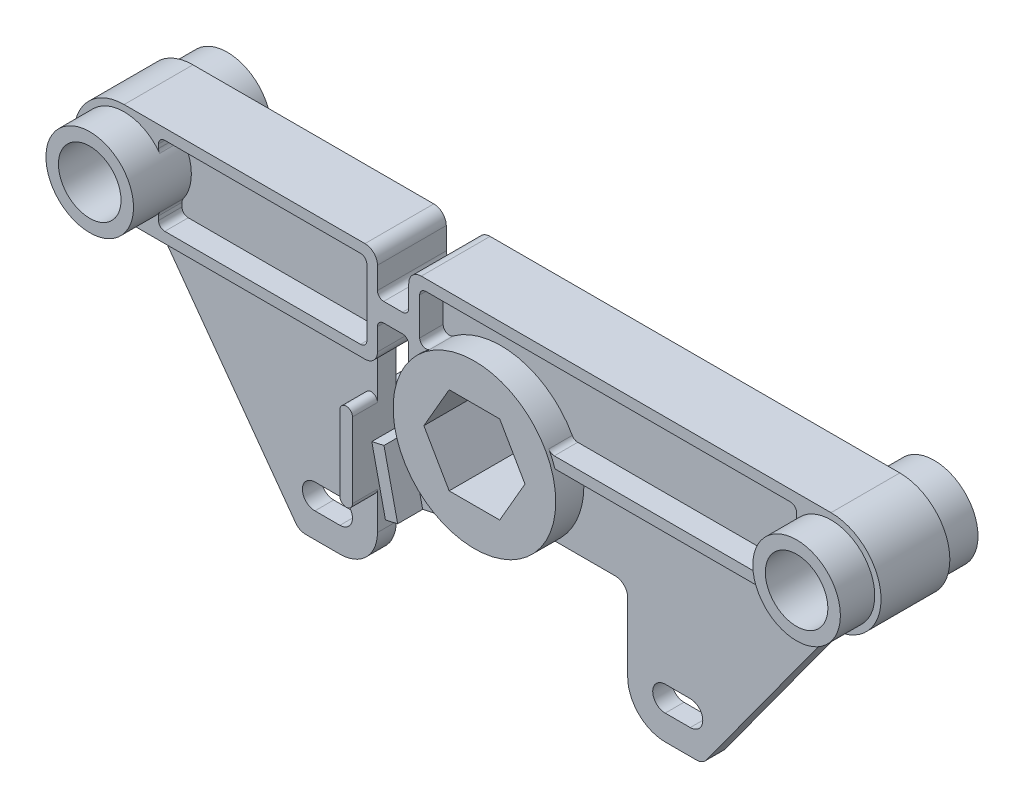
SolidWorks part; units mm, degrees
ref_plane "Plan1" through (0, 0, 0) normal (0, 0, 1) x (1, 0, 0)
ref_plane "Plan2" through (0, 0, 0) normal (0, 1, 0) x (1, 0, 0)
ref_plane "Plan3" through (0, 0, 0) normal (1, 0, 0) x (0, 0, -1)
sketch "Esquisse1" plane through (0, 0, 0) normal (0, 0, 1) x (1, 0, 0)
  circle A0 centre (0, 0) radius 13
  dimension "D1" = 26
extrude "Moyeu" add sketch "Esquisse1" along normal mid plane 12
sketch "Esquisse2" plane through (0, 0, 0) normal (0, 0, 1) x (1, 0, 0)
  line L0 (-11, 20) -> (56.5, 20)
  line L1 (-11, 20) -> (-11, 13.5)
  line L2 (-11, 4) -> (56.5, 4)
  line L3 (-16, 20) -> (-16, 13.5)
  line L4 (-16, 20) -> (-56.5, 20)
  line L5 (-16, 4) -> (-56.5, 4)
  line L6 (-16, 13.5) -> (-11, 13.5)
  line L7 (-16, 10.5) -> (-11, 10.5)
  line L8 (-16, 10.5) -> (-16, 4)
  line L9 (-11, 10.5) -> (-11, 4)
  arc A0 (56.5, 4) -> (56.5, 20) centre (56.5, 12) ccw
  arc A1 (-56.5, 20) -> (-56.5, 4) centre (-56.5, 12) ccw
  dimension "D1" = 20
  dimension "D2" = 11
  dimension "D3" = 16
  dimension "D4" = 67.5
  dimension "D5" = 5
  dimension "D6" = 40.5
  dimension "D7" = 3
  dimension "D8" = 1.5
extrude "poutre" add sketch "Esquisse2" along normal mid plane 11
sketch "Esquisse3" plane through (0, 0, 0) normal (0, 0, 1) x (1, 0, 0)
  circle A0 centre (56.5, 12) radius 7
  dimension "D1" = 14
extrude "palier grand côté" add sketch "Esquisse3" along normal mid plane 22
sketch "Esquisse7" plane through (0, 0, 0) normal (0, 0, 1) x (1, 0, 0)
  circle A0 centre (-56.5, 12) radius 7
  arc A1 (-56.5, 20) -> (-56.5, 4) centre (-56.5, 12) ccw construction
  dimension "D1" = 14
extrude "palier petit côté" add sketch "Esquisse7" along normal mid plane 22
sketch "Esquisse8" plane through (0, 0, 11) normal (0, 0, 1) x (1, 0, 0)
  circle A0 centre (-56.5, 12) radius 5
  circle A1 centre (-56.5, 12) radius 7 construction
  dimension "D1" = 10
extrude "alésage petit côté" cut sketch "Esquisse8" against normal through all
sketch "Esquisse9" plane through (0, 0, 11) normal (0, 0, 1) x (1, 0, 0)
  circle A0 centre (56.5, 12) radius 5
  circle A1 centre (56.5, 12) radius 7 construction
  dimension "D1" = 10
extrude "alésage grand côté" cut sketch "Esquisse9" against normal through all
sketch "Esquisse10" plane through (0, 0, 5.5) normal (0, 0, 1) x (1, 0, 0)
  line L10 (-51, 18.3) -> (-51, 16.3301)
  line L11 (-51, 7.6699) -> (-51, 5.7)
  line L12 (-17.7, 5.7) -> (-17.7, 18.3)
  line L13 (-17.7, 5.7) -> (-17.7, 18.3)
  line L20 (-17.7, 18.3) -> (-56.5, 18.3)
  line L21 (-56.5, 5.7) -> (-17.7, 5.7)
  line L23 (-17.7, 18.3) -> (-51, 18.3)
  line L24 (-51, 5.7) -> (-17.7, 5.7)
  circle A3 centre (-56.5, 12) radius 7 construction
  arc A4 (-51, 7.6699) -> (-51, 16.3301) centre (-56.5, 12) ccw
  arc A6 (-56.5, 18.3) -> (-56.5, 5.7) centre (-56.5, 12) ccw
  dimension "D2" = 5.5
  dimension "D1" = 1.7
extrude "évidement poutre petit côté" cut sketch "Esquisse10" against normal blind 3.75
sketch "Esquisse11" plane through (0, 0, 5.5) normal (0, 0, 1) x (1, 0, 0)
  line L0 (51, 18.25) -> (-9.25, 18.25)
  line L1 (56.5, 20) -> (-11, 20) construction
  line L2 (51, 5.75) -> (11.6592, 5.75)
  line L4 (12.3693, 4) -> (56.5, 4) construction
  line L5 (-9.25, 18.25) -> (-9.25, 9.1344)
  line L6 (-11, 20) -> (-11, 13.5) construction
  line L7 (51, 18.25) -> (51, 16.3301)
  line L8 (51, 7.6699) -> (51, 5.75)
  circle A0 centre (0, 0) radius 13 construction
  arc A1 (11.6592, 5.75) -> (-9.25, 9.1344) centre (0, 0) ccw
  circle A4 centre (56.5, 12) radius 7 construction
  arc A5 (51, 16.3301) -> (51, 7.6699) centre (56.5, 12) ccw
  dimension "D1" = 1.75
  dimension "D2" = 1.75
  dimension "D3" = 1.75
  dimension "D4" = 5.5
extrude "évidement poutre grand côté" cut sketch "Esquisse11" against normal blind 3.75
fillet "Congés inter de 1" radius 1
mirror "Symétrie1" about plane through (0, 0, 0) normal (0, 0, 1)
fillet " Congés exter de 2" radius 2
fillet "Congés de 1articulation" radius 1
sketch "Esquisse13" plane through (0, 0, 0) normal (0, 0, 1) x (1, 0, 0)
  line L0 (26, -29) -> (30.9809, -29)
  line L1 (12.3693, 4) -> (56.5, 4) construction
  line L2 (4.8666, -10) -> (18, -10)
  line L3 (20, -12) -> (20, -23)
  line L4 (56.7046, 5.003) -> (32.599, -28.1756)
  arc A0 (18, -10) -> (20, -12) centre (18, -12) cw
  circle A1 centre (56.5, 12) radius 7 construction
  arc A2 (32.599, -28.1756) -> (30.9809, -29) centre (30.9809, -27) cw
  arc A3 (26, -29) -> (20, -23) centre (26, -23) cw
  point P14 (32, -29)
  point P17 (20, -29)
  dimension "D4" = 2
  dimension "D7" = 2
  dimension "D8" = 6
  dimension "D1" = 33
  dimension "D2" = 14
  dimension "D3" = 20
  dimension "D5" = 12
  dimension "D6" = 126
rib "pate ressort grand coté" sketch "Esquisse13" sketch "Esquisse13" thickness 3 extrusion direction parallel to sketch draft on no parameters "D1"=3
sketch "Esquisse14" plane through (0, 0, 0) normal (0, 0, 1) x (1, 0, 0)
  line L0 (-20, 5.7) -> (-20, -23)
  line L1 (-50, 5.7) -> (-18.7, 5.7) construction
  line L2 (-31.4809, -29) -> (-26, -29)
  line L3 (-56.5, 4) -> (-18, 4) construction
  line L4 (-16, 6) -> (-16, 9.5) construction
  line L5 (-56.8582, 4.5262) -> (-33.099, -28.1756)
  arc A0 (-26, -29) -> (-20, -23) centre (-26, -23) ccw
  arc A1 (-31.4809, -29) -> (-33.099, -28.1756) centre (-31.4809, -27) cw
  point P15 (-32.5, -29)
  dimension "D3" = 6
  dimension "D6" = 2
  dimension "D1" = 33
  dimension "D2" = 4
  dimension "D4" = 126
  dimension "D5" = 12.5
rib "pate ressort petit côté" sketch "Esquisse14" sketch "Esquisse14" thickness 3 extrusion direction parallel to sketch draft on no parameters "D1"=3
sketch "Esquisse15" plane through (0, 0, 0) normal (0, 0, 1) x (1, 0, 0)
  line L0 (-20, -23) -> (-20, 4) construction
  line L1 (-20, -17) -> (-20, -5)
  line L2 (-22, -5) -> (-22, -17)
  line L3 (-56.5, 4) -> (-18, 4) construction
  arc A0 (-20, -5) -> (-22, -5) centre (-21, -5) ccw
  arc A1 (-22, -17) -> (-20, -17) centre (-21, -17) ccw
  dimension "D1" = 2
  dimension "D2" = 21
  dimension "D3" = 9
extrude "buté petit coté" add sketch "Esquisse15" along normal mid plane 11
sketch "Esquisse16" plane through (0, 0, 0) normal (0, 0, 1) x (1, 0, 0)
  line L0 (2.8409, -12.6858) -> (-14.7241, -16.6193)
  line L1 (-16.9094, -6.861) -> (-10.3548, -5.3932)
  line L2 (-16.9094, -6.861) -> (-14.7241, -16.6193)
  circle A0 centre (0, 0) radius 13 construction
  arc A1 (-22, -17) -> (-20, -17) centre (-21, -17) ccw construction
  dimension "D1" = 10
  dimension "D2" = 18
rib "Nervure de buté" sketch "Esquisse16" sketch "Esquisse16" thickness 3 extrusion direction parallel to sketch draft on no parameters "D1"=3
sketch "Esquisse17" plane through (0, 0, 0) normal (0, 0, 1) x (1, 0, 0)
  line L0 (-14.7241, -16.6193) -> (-16.9094, -6.861) construction
  line L1 (-14.7241, -16.6193) -> (-16.9094, -6.861)
  line L2 (-14.9577, -6.424) -> (-12.7724, -16.1823)
  line L3 (-16.9094, -6.861) -> (-14.9577, -6.424)
  line L4 (-14.7241, -16.6193) -> (-12.7724, -16.1823)
  dimension "D1" = 2
extrude "buté sur moyeu" add sketch "Esquisse17" along normal mid plane 11
fillet "Congé de buté" radius 2
sketch "Esquisse18" plane through (0, 0, 1.5) normal (0, 0, 1) x (1, 0, 0)
  line L0 (26, -21) -> (30, -21)
  line L1 (26, -25) -> (30, -25)
  line L2 (12.3693, 4) -> (56.5, 4) construction
  arc A0 (26, -21) -> (26, -25) centre (26, -23) ccw
  arc A1 (30, -25) -> (30, -21) centre (30, -23) ccw
  dimension "D1" = 4
  dimension "D2" = 25
  dimension "D3" = 4
extrude "trou oblong ressort grand coté" cut sketch "Esquisse18" against normal through all
mirror "Symétrie2" about plane through (0, 0, 0) normal (1, 0, 0)
sketch "Esquisse19" plane through (0, 0, 6) normal (0, 0, 1) x (1, 0, 0)
  line L1 (8.0829, 0) -> (4.0415, 7)
  line L2 (4.0415, 7) -> (-4.0415, 7)
  line L3 (-4.0415, 7) -> (-8.0829, 0)
  line L4 (-8.0829, 0) -> (-4.0415, -7)
  line L5 (-4.0415, -7) -> (4.0415, -7)
  line L6 (4.0415, -7) -> (8.0829, 0)
  circle A0 centre (0, 0) radius 7 construction
  dimension "D1" = 14
extrude "Enlèv. mat.-Extru.1" cut sketch "Esquisse19" against normal through all
